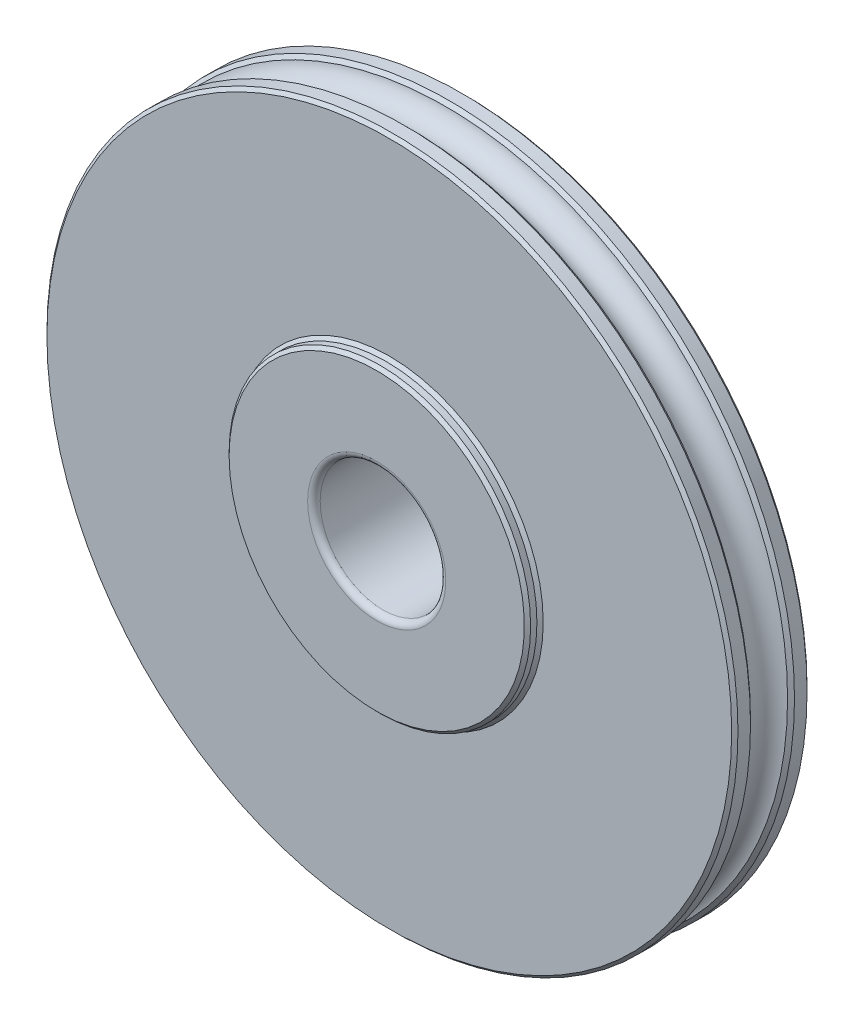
SolidWorks part; units mm, degrees
ref_plane "Спереди" through (0, 0, 0) normal (0, 0, 1) x (1, 0, 0)
ref_plane "Сверху" through (0, 0, 0) normal (0, 1, 0) x (1, 0, 0)
ref_plane "Справа" through (0, 0, 0) normal (1, 0, 0) x (0, 0, -1)
sketch "Эскиз1" plane through (0, 0, 0) normal (1, 0, 0) x (0, 0, -1)
  line L0 (-4, 0) -> (4, 0) construction
  line L1 (-4, 5) -> (4, 5)
  line L2 (4, 5) -> (4, 12)
  line L3 (4, 12) -> (3, 12)
  line L4 (3, 12) -> (3, 27.5)
  line L5 (3, 27.5) -> (1.5, 27.5)
  line L6 (-4, 5) -> (-4, 12)
  line L7 (-4, 12) -> (-3, 12)
  line L8 (-3, 12) -> (-3, 27.5)
  line L9 (-3, 27.5) -> (-1.5, 27.5)
  arc A0 (-1.5, 27.5) -> (1.5, 27.5) centre (0, 27.5) ccw
  dimension "D1" = 3
  dimension "D2" = 6
  dimension "D3" = 8
  dimension "D4" = 10
  dimension "D5" = 24
  dimension "D6" = 55
revolve "Повернуть1" add sketch "Эскиз1" angle 360 about L0
chamfer "Фаска1" distance 0.25 angle 45 8 edges at (27.5, 0, 1.5) (27.5, 0, 3) (27.5, 0, -3) (27.5, 0, -1.5) (12, 0, -4) (12, 0, -3) (12, 0, 3) (12, 0, 4)
fillet "Скругление1" radius 0.5 2 edges at (5, 0, 4) (5, 0, -4)
